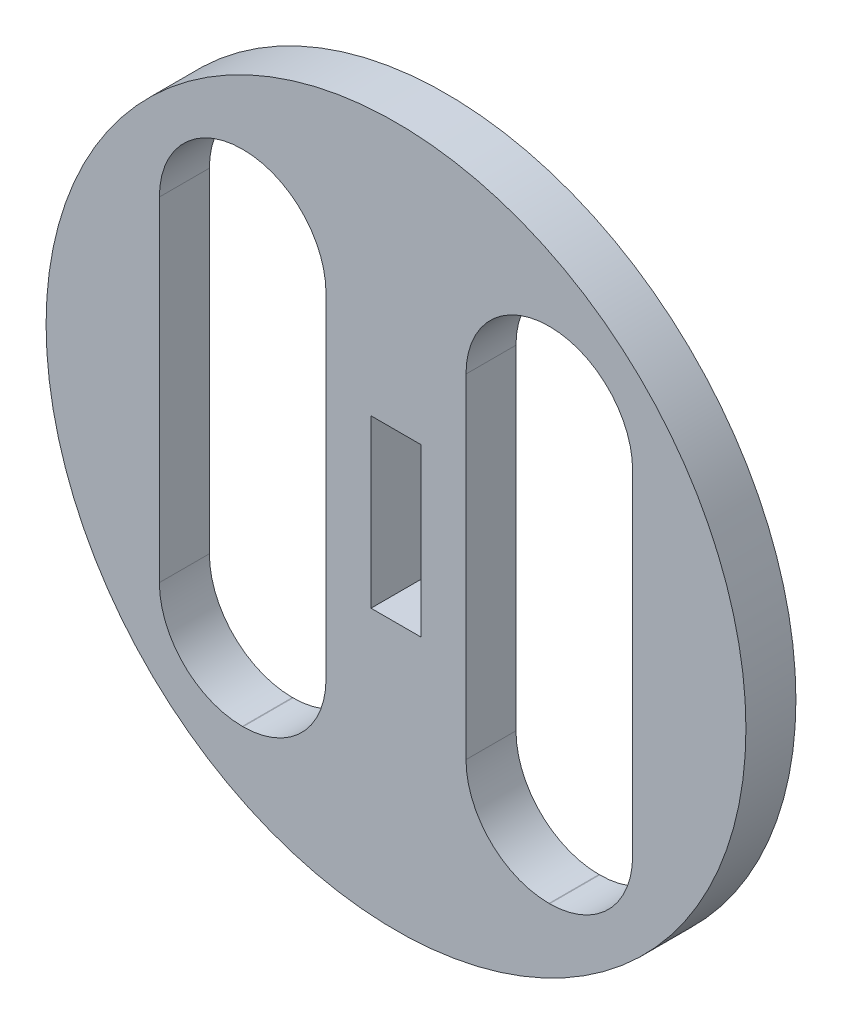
SolidWorks part; units mm, degrees
ref_plane "Front Plane" through (0, 0, 0) normal (0, 0, 1) x (1, 0, 0)
ref_plane "Top Plane" through (0, 0, 0) normal (0, 1, 0) x (1, 0, 0)
ref_plane "Right Plane" through (0, 0, 0) normal (1, 0, 0) x (0, 0, -1)
sketch "Sketch1" plane through (0, 0, 0) normal (0, 0, 1) x (1, 0, 0)
  circle A0 centre (0, 0) radius 26.67
  dimension "D1" = 53.34
extrude "Extrude1" add sketch "Sketch1" along normal blind 3.81
sketch "Sketch2" plane through (0, 0, 0) normal (0, 0, 1) x (1, 0, 0)
  line L0 (0, -29.206) -> (0, 29.28) construction
  line L1 (27.2748, 0) -> (-29.4666, 0) construction
  line L2 (-11.7094, 19.05) -> (-11.6586, 19.05)
  line L3 (-18.034, 12.7254) -> (-18.034, -12.7254)
  line L4 (-11.7094, -19.05) -> (-11.6586, -19.05)
  line L5 (-5.334, 12.7254) -> (-5.334, -12.7254)
  line L6 (11.6586, 19.05) -> (11.7094, 19.05)
  line L7 (5.334, 12.7254) -> (5.334, -12.7254)
  line L8 (11.6586, -19.05) -> (11.7094, -19.05)
  line L9 (18.034, 12.7254) -> (18.034, -12.7254)
  arc A0 (-18.034, 12.7254) -> (-11.7094, 19.05) centre (-11.7094, 12.7254) cw
  arc A1 (-5.334, 12.7254) -> (-11.6586, 19.05) centre (-11.6586, 12.7254) ccw
  arc A2 (-11.7094, -19.05) -> (-18.034, -12.7254) centre (-11.7094, -12.7254) cw
  arc A3 (-11.6586, -19.05) -> (-5.334, -12.7254) centre (-11.6586, -12.7254) ccw
  arc A4 (5.334, 12.7254) -> (11.6586, 19.05) centre (11.6586, 12.7254) cw
  arc A5 (18.034, 12.7254) -> (11.7094, 19.05) centre (11.7094, 12.7254) ccw
  arc A6 (11.7094, -19.05) -> (18.034, -12.7254) centre (11.7094, -12.7254) ccw
  arc A7 (5.334, -12.7254) -> (11.6586, -19.05) centre (11.6586, -12.7254) ccw
  point P15 (-18.034, 19.05)
  point P18 (-5.334, 19.05)
  point P21 (-18.034, -19.05)
  point P26 (5.334, 19.05)
  point P29 (18.034, 19.05)
  point P32 (18.034, -19.05)
  dimension "D5" = 5.334
  dimension "D9" = 6.3246
  dimension "D1" = 38.1
  dimension "D2" = 38.1
  dimension "D3" = 12.7
  dimension "D4" = 12.7
  dimension "D6" = 5.334
  dimension "D7" = 19.05
  dimension "D8" = 19.05
extrude "Cut-Extrude1" cut sketch "Sketch2" along normal through all
sketch "Sketch3" plane through (0, 0, 0) normal (0, 0, 1) x (1, 0, 0)
  line L0 (26.67, 0) -> (-26.67, 0) construction
  line L1 (-1.905, 6.35) -> (1.905, 6.35)
  line L2 (-1.905, 6.35) -> (-1.905, -6.35)
  line L3 (-1.905, -6.35) -> (1.905, -6.35)
  line L4 (1.905, 6.35) -> (1.905, -6.35)
  line L5 (0, -26.67) -> (0, 27.133) construction
  circle A0 centre (0, 0) radius 26.67 construction
  dimension "D1" = 3.81
  dimension "D2" = 12.7
  dimension "D3" = 6.35
  dimension "D4" = 1.905
extrude "Cut-Extrude2" cut sketch "Sketch3" along normal through all
